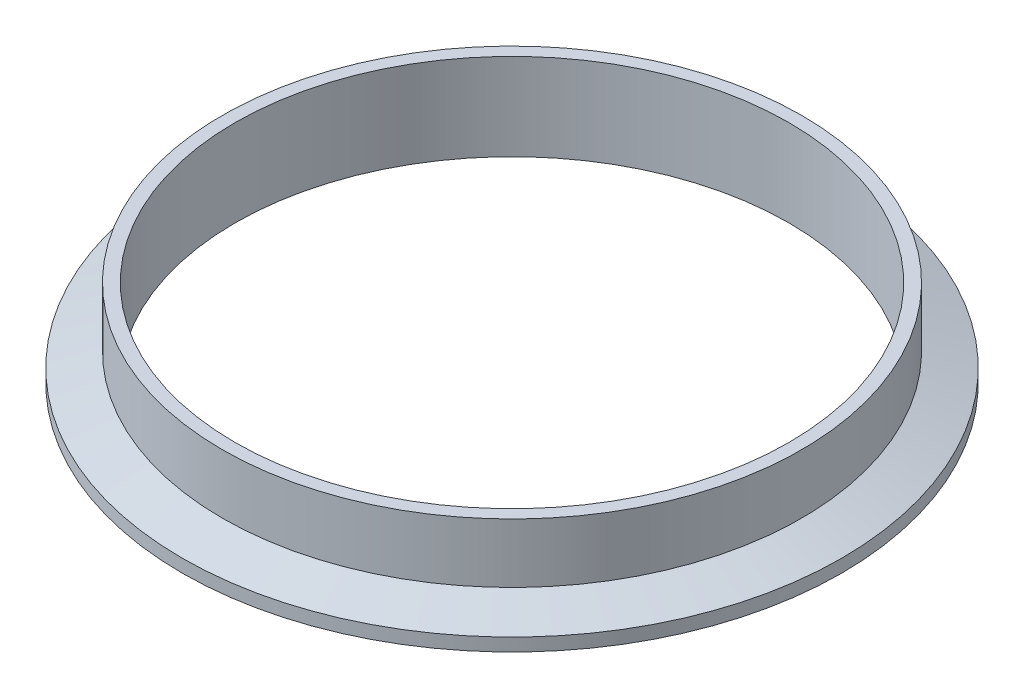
SolidWorks part; units mm, degrees
ref_plane "Front Plane" through (0, 0, 0) normal (0, 0, 1) x (1, 0, 0)
ref_plane "Top Plane" through (0, 0, 0) normal (0, 1, 0) x (1, 0, 0)
ref_plane "Right Plane" through (0, 0, 0) normal (1, 0, 0) x (0, 0, -1)
sketch "Sketch1" plane through (0, 0, 0) normal (0, 0, 1) x (1, 0, 0)
  line L0 (0, 0) -> (0, 19.05) construction
  line L1 (0, 19.05) -> (-63.5, 19.05)
  line L2 (-63.5, 19.05) -> (-63.5, 6.0435)
  line L3 (-63.5, 6.0435) -> (-72.2884, 2.8448)
  line L4 (-72.2884, 2.8448) -> (-72.2884, 0)
  line L5 (-72.2884, 0) -> (-69.2804, 0)
  line L6 (-65.6444, 0) -> (0, 0)
  line L7 (0, 0) -> (0, 19.05)
  line L8 (0, 19.05) -> (-60.7314, 19.05)
  line L9 (-60.7314, 19.05) -> (-60.7314, 0)
  line L10 (-60.7314, 0) -> (0, 0)
  line L11 (0, 0) -> (-0.1846, 0.0129)
  arc A0 (-68.5579, 0.4745) -> (-66.3669, 0.4745) centre (-67.4624, 0) cw
  arc A1 (-65.6444, 0) -> (-66.3669, 0.4745) centre (-65.6444, 0.7874) cw
  arc A2 (-68.5579, 0.4745) -> (-69.2804, 0) centre (-69.2804, 0.7874) cw
  point P12 (-66.2686, 0)
  dimension "D6" = 1.1938
  dimension "D7" = 0.7874
  dimension "D1" = 63.5
  dimension "D2" = 2.8448
  dimension "D3" = 72.2884
  dimension "D4" = 70
  dimension "D5" = 67.4624
  dimension "D8" = 2.7686
  dimension "D9" = 19.05
revolve "Revolve2" add sketch "Sketch1" angle 360 about L0
